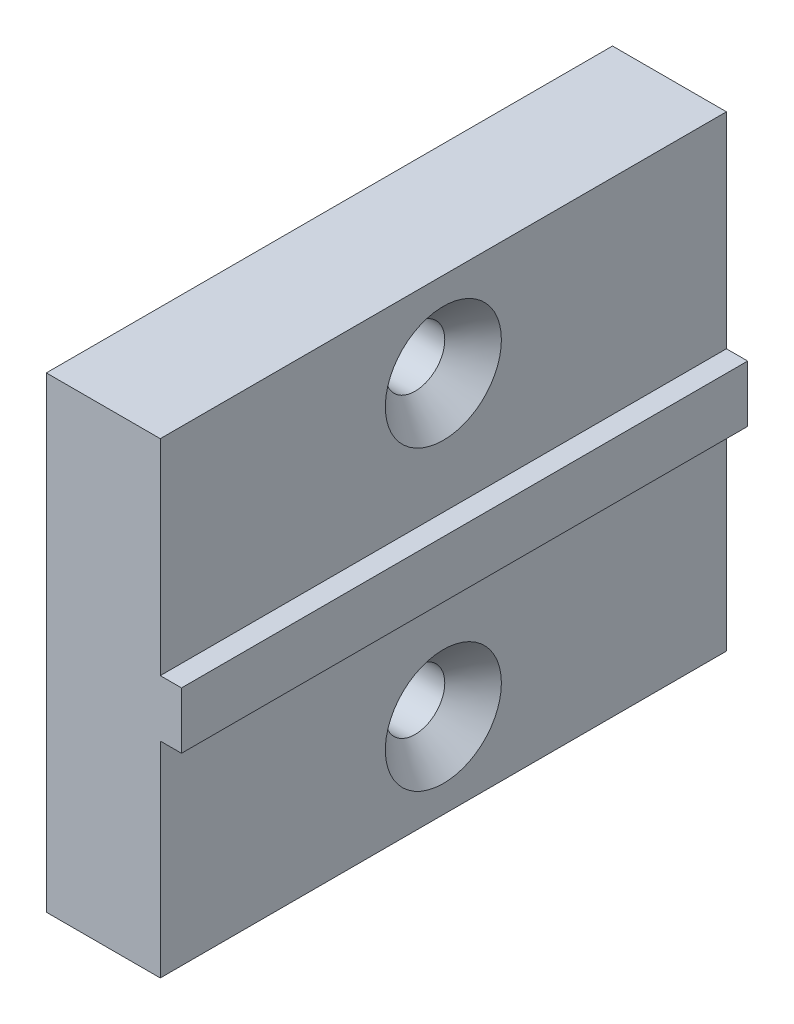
SolidWorks part; units mm, degrees
ref_plane "Plan de face" through (0, 0, 0) normal (0, 0, 1) x (1, 0, 0)
ref_plane "Plan de dessus" through (0, 0, 0) normal (0, 1, 0) x (1, 0, 0)
ref_plane "Plan de droite" through (0, 0, 0) normal (1, 0, 0) x (0, 0, -1)
ref_plane "Plan1" through (9.55, 0, 0) normal (1, 0, 0) x (0, 0, -1)
sketch "Esquisse1" plane through (9.55, 0, 0) normal (1, 0, 0) x (0, 0, -1)
  line L0 (40, -16.5) -> (40, 16.5)
  line L1 (40, 16.5) -> (0, 16.5)
  line L2 (0, 16.5) -> (0, -16.5)
  line L3 (0, -16.5) -> (40, -16.5)
extrude "Boss.-Extru.1" add sketch "Esquisse1" against normal blind 9.55
sketch "Esquisse2" plane through (0, 0, -40) normal (0, 0, -1) x (-1, 0, 0)
  line L0 (-8.05, -16.5) -> (-8.05, -2)
  line L1 (-8.05, -2) -> (-9.55, -2)
  line L2 (-9.55, -2) -> (-9.55, -16.5)
  line L3 (-9.55, -16.5) -> (-8.05, -16.5)
extrude "Enlèv. mat.-Extru.1" cut sketch "Esquisse2" against normal through all
sketch "Esquisse3" plane through (0, 0, -40) normal (0, 0, -1) x (-1, 0, 0)
  line L0 (-9.55, 16.5) -> (-9.55, 2)
  line L1 (-9.55, 2) -> (-8.05, 2)
  line L2 (-8.05, 2) -> (-8.05, 16.5)
  line L3 (-8.05, 16.5) -> (-9.55, 16.5)
extrude "Enlèv. mat.-Extru.2" cut sketch "Esquisse3" against normal through all
hole_wizard "Diamètre du perçage Ø4.2 (4.2)1" positions "Esquisse5" profile "Esquisse4" hole size "Ø4.2" standard "Ansi Metric"
sketch "Esquisse5" plane through (8.05, 0, 0) normal (1, 0, 0) x (0, 0, -1)
  point P0 (20, -10.5)
  point P1 (20, 10.5)
sketch "Esquisse4" plane through (8.05, -10.5, -20) normal (0, 1, 0) x (0, 0, -1)
  line L0 (0, 0) -> (0, 8.05)
  line L1 (0, 8.05) -> (2.1, 8.05)
  line L2 (2.1, 8.05) -> (2.1, 0)
  line L5 (2.1, 0) -> (0, 0)
  line L11 (0, -6.35) -> (0, 107.95) construction
  dimension "Diamètre du perçage jusqu'au prochain" = 4.2
  dimension "Profondeur du perçage jusqu'au prochain" = 8.05
chamfer "Chanfrein1" distance 2 angle 45 2 edges at (8.05, 10.5, -22.1) (8.05, -10.5, -22.1)
